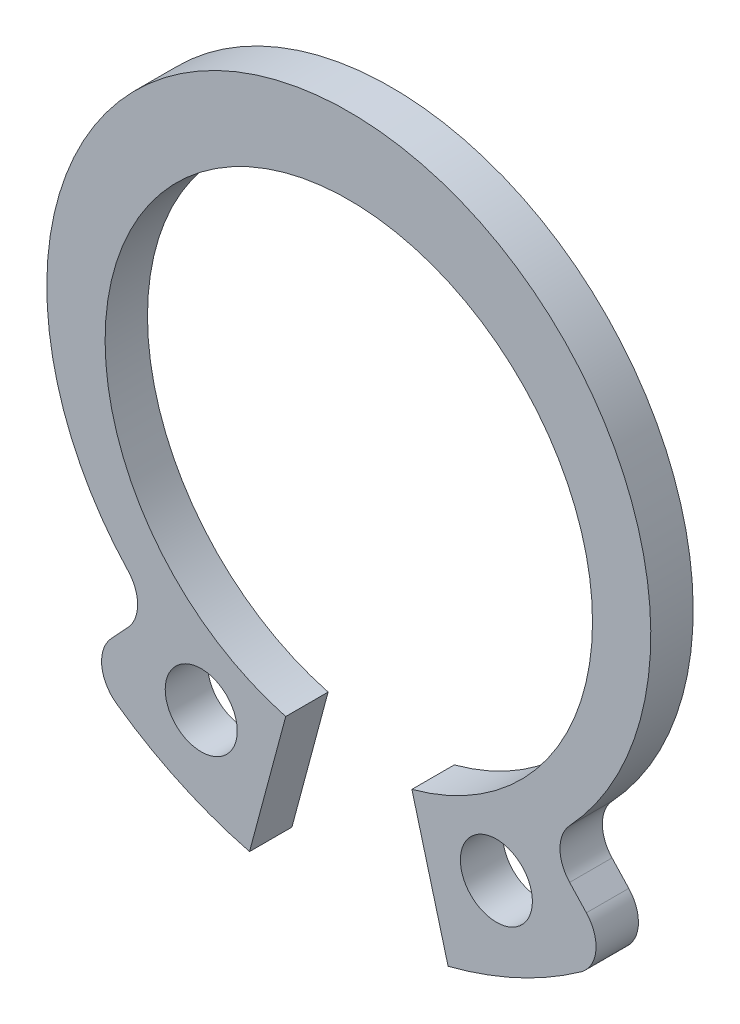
SolidWorks part; units mm, degrees
ref_plane "Plan1" through (0, 0, 0) normal (0, 0, 1) x (1, 0, 0)
ref_plane "Plan2" through (0, 0, 0) normal (0, 1, 0) x (1, 0, 0)
ref_plane "Plan3" through (0, 0, 0) normal (1, 0, 0) x (0, 0, -1)
sketch "Esquisse1" plane through (0, 0, 0) normal (0, 0, 1) x (1, 0, 0)
  line L0 (0, 0) -> (2.3423, -8.7416) construction
  line L1 (0, 0) -> (0, -67.082) construction
  line L2 (5.2099, -5.5939) -> (5.6053, -6.0185)
  line L3 (1.4882, -5.5541) -> (2.3423, -8.7416)
  line L4 (-1.4882, -5.5541) -> (-2.3423, -8.7416)
  line L5 (-5.2099, -5.5939) -> (-5.6053, -6.0185)
  line L6 (1.4882, -5.5541) -> (5.4751, -7.291) construction
  line L7 (0, 0) -> (0, 5.75) construction
  line L8 (0, 5.75) -> (0, 7.55) construction
  arc A0 (1.4882, -5.5541) -> (-1.4882, -5.5541) centre (0, 0) ccw
  arc A1 (2.3423, -8.7416) -> (5.4751, -7.291) centre (0, 0.425) ccw
  arc A2 (5.2103, -4.4349) -> (-5.2103, -4.4349) centre (0, 0.425) ccw
  arc A3 (-5.4751, -7.291) -> (-2.3423, -8.7416) centre (0, 0.425) ccw
  arc A4 (-5.2103, -4.4349) -> (-5.2099, -5.5939) centre (-5.8319, -5.0146) cw
  arc A5 (5.2103, -4.4349) -> (5.2099, -5.5939) centre (5.8319, -5.0146) ccw
  circle A6 centre (3.4817, -6.4225) radius 0.85
  circle A7 centre (-3.4817, -6.4225) radius 0.85
  arc A8 (-5.4751, -7.291) -> (-5.6053, -6.0185) centre (-4.9832, -6.5978) cw
  arc A9 (5.4751, -7.291) -> (5.6053, -6.0185) centre (4.9832, -6.5978) ccw
  point P8 (0, 0)
  point P22 (-6.2332, -6.6927)
  dimension "D1" = 11.5
  dimension "D2" = 3.3
  dimension "D3" = 1.8
  dimension "R" = 0.85
  dimension "D8" = 1.7
  dimension "D4" = 0.425
  dimension "D5" = 4.25
  dimension "a" = 15
extrude "Base-Extrusion" add sketch "Esquisse1" along normal blind 1
equation "\"R@Esquisse1\" = \"D8@Esquisse1\"/2"
equation "\"D4@Esquisse1\"=\"R@Esquisse1\"/2"
equation "\"D5@Esquisse1\"=\"D8@Esquisse1\"*2.5"
